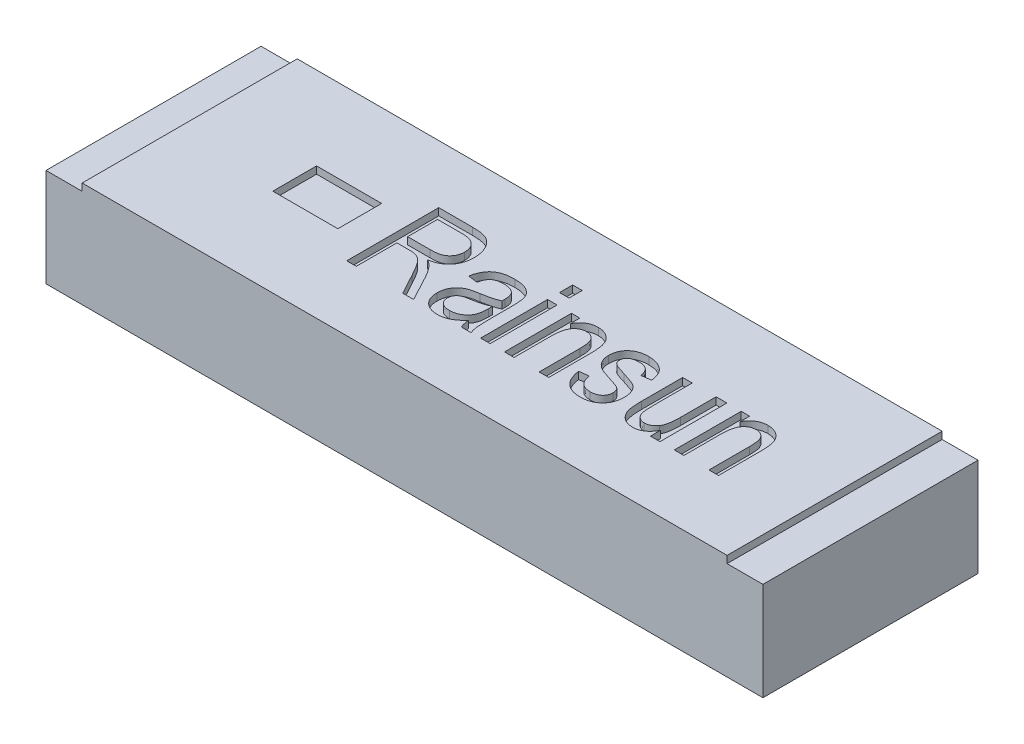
SolidWorks part; units mm, degrees
ref_plane "Plan de face" through (0, 0, 0) normal (0, 0, 1) x (1, 0, 0)
ref_plane "Plan de dessus" through (0, 0, 0) normal (0, 1, 0) x (1, 0, 0)
ref_plane "Plan de droite" through (0, 0, 0) normal (1, 0, 0) x (0, 0, -1)
sketch "Esquisse1" plane through (0, 0, 0) normal (0, 1, 0) x (1, 0, 0)
  line L1 (-5, -1.5) -> (5, -1.5)
  line L2 (-5, -1.5) -> (-5, 1.5)
  line L3 (-5, 1.5) -> (5, 1.5)
  line L4 (5, -1.5) -> (5, 1.5)
  line L5 (-5, -1.5) -> (5, 1.5) construction
  line L6 (-5, 1.5) -> (5, -1.5) construction
  point P0 (0, 0)
  dimension "D1" = 10
  dimension "D2" = 3
extrude "Boss.-Extru.1" add sketch "Esquisse1" along normal blind 1.47
sketch "Esquisse2" plane through (0, 1.47, 0) normal (0, 1, 0) x (1, 0, 0)
  line L0 (0, 0) -> (-2.6139, 0.0364) construction
  line L2 (-3.0676, -0.2688) -> (-2.1603, -0.2688)
  line L3 (-3.0676, -0.2688) -> (-3.0676, 0.3417)
  line L4 (-3.0676, 0.3417) -> (-2.1603, 0.3417)
  line L5 (-2.1603, -0.2688) -> (-2.1603, 0.3417)
  line L6 (-3.0676, -0.2688) -> (-2.1603, 0.3417) construction
  line L7 (-3.0676, 0.3417) -> (-2.1603, -0.2688) construction
extrude "Enlèv. mat.-Extru.1" cut sketch "Esquisse2" against normal blind 0.1
sketch "Esquisse3" plane through (0, 1.47, 0) normal (0, 1, 0) x (1, 0, 0)
  line L0 (-5, -1.5) -> (5, -1.5) construction
  line L1 (-5, 1.5) -> (-4.4957, 1.5)
  line L2 (-5, 1.5) -> (-5, -1.5)
  line L3 (-5, -1.5) -> (-4.4957, -1.5)
  line L4 (-4.4957, 1.5) -> (-4.4957, -1.5)
  line L6 (5, 1.5) -> (4.5, 1.5)
  line L7 (5, 1.5) -> (5, -1.5)
  line L8 (5, -1.5) -> (4.5, -1.5)
  line L9 (4.5, 1.5) -> (4.5, -1.5)
extrude "Enlèv. mat.-Extru.2" cut sketch "Esquisse3" against normal blind 0.1
sketch "Esquisse4" plane through (0, 1.47, 0) normal (0, 1, 0) x (1, 0, 0)
  text T0 "Rainsun" font "Arial Narrow" height in points 5
extrude "Enlèv. mat.-Extru.3" cut sketch "Esquisse4" against normal blind 0.1
